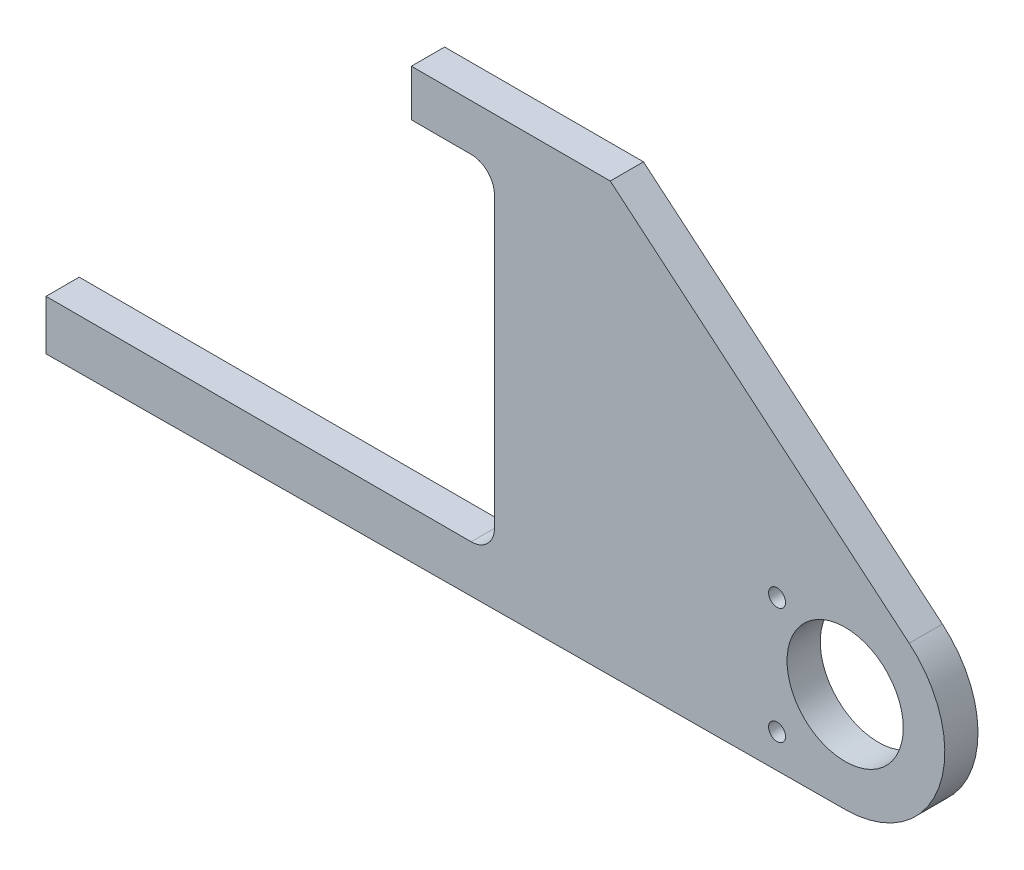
SolidWorks part; units mm, degrees
ref_plane "Plan de face" through (0, 0, 0) normal (0, 0, 1) x (1, 0, 0)
ref_plane "Plan de dessus" through (0, 0, 0) normal (0, 1, 0) x (1, 0, 0)
ref_plane "Plan de droite" through (0, 0, 0) normal (1, 0, 0) x (0, 0, -1)
sketch "Esquisse1" plane through (0, 0, 0) normal (0, 0, 1) x (1, 0, 0)
  line L0 (-481.18, -33) -> (-225.18, -33)
  line L1 (-211.18, -19) -> (-211.18, 155)
  line L4 (0.3739, -59.9988) -> (-481.18, -63)
  line L5 (-481.18, -33) -> (-481.18, -63)
  line L6 (-225.18, 169) -> (-261.18, 169)
  line L7 (-261.18, 169) -> (-261.18, 197)
  line L8 (-261.18, 197) -> (-141.432, 197)
  line L9 (-141.432, 197) -> (38.5673, 45.9627)
  arc A0 (38.5673, 45.9627) -> (0.3739, -59.9988) centre (0, 0) cw
  circle A1 centre (0, 0) radius 35
  arc A2 (-211.18, 155) -> (-225.18, 169) centre (-225.18, 155) ccw
  arc A3 (-225.18, -33) -> (-211.18, -19) centre (-225.18, -19) ccw
  point P9 (60, 0)
  point P16 (-211.18, 169)
  point P19 (-211.18, -33)
  dimension "D7" = 60
  dimension "D8" = 70
  dimension "D5" = 14
  dimension "D1" = 211.18
  dimension "D2" = 33
  dimension "D3" = 30
  dimension "D4" = 202
  dimension "D6" = 270
  dimension "D9" = 541.18
  dimension "D11" = 50
  dimension "D12" = 28
  dimension "D13" = 140
extrude "Extrusion1" add sketch "Esquisse1" along normal blind 20
hole_wizard "Trou taraudé M121" positions "Esquisse3" profile "Esquisse2" tap size "M12" standard "ISO"
sketch "Esquisse3" plane through (0, 0, 20) normal (0, 0, 1) x (1, 0, 0)
  point P0 (-41, 30)
  point P1 (-41, -40)
  dimension "D1" = 41
  dimension "D2" = 30
  dimension "D3" = 40
  dimension "D4" = 70
sketch "Esquisse2" plane through (-41, 30, 20) normal (1, 0, 0) x (0, -1, 0)
  line L0 (0, 0) -> (0, 32.3144)
  line L1 (0, 32.3144) -> (5.1, 29.25)
  line L2 (5.1, 29.25) -> (5.1, 0)
  line L5 (5.1, 0) -> (0, 0)
  line L10 (0, 32.3144) -> (-5.1, 29.25) construction
  line L11 (0, -6.35) -> (0, 107.95) construction
  dimension "Diamètre du trou pour taraudage" = 10.2
  dimension "Profondeur du trou pour taraudage" = 29.25
  dimension "Angle de pointe" = 118
